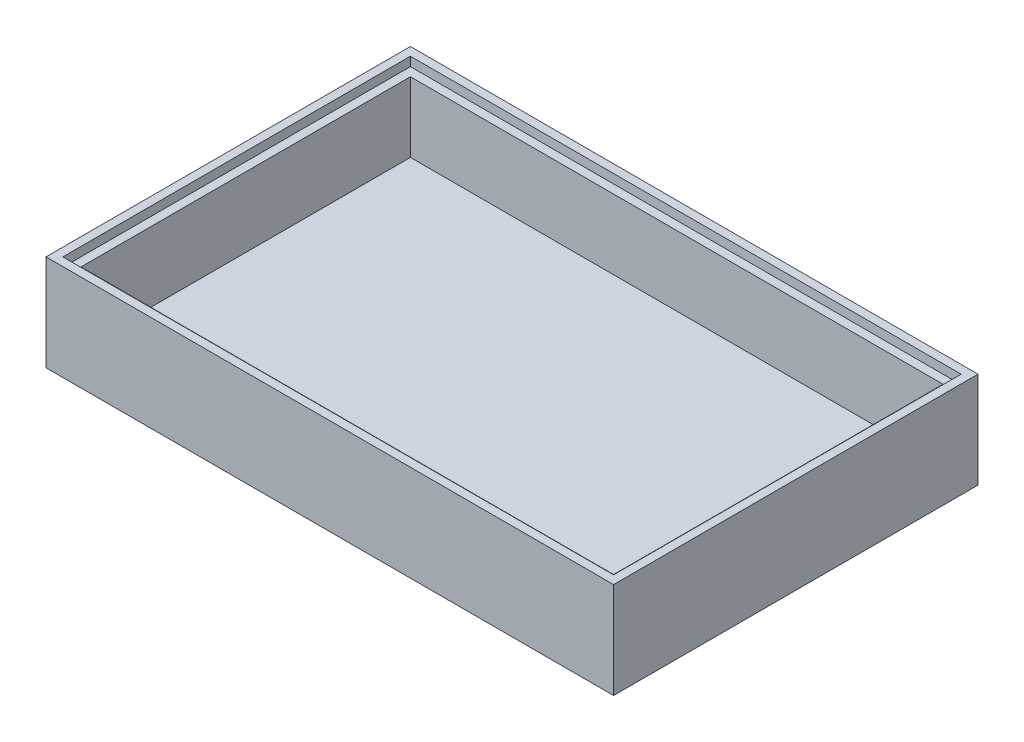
SolidWorks part; units mm, degrees
ref_plane "Front Plane" through (0, 0, 0) normal (0, 0, 1) x (1, 0, 0)
ref_plane "Top Plane" through (0, 0, 0) normal (0, 1, 0) x (1, 0, 0)
ref_plane "Right Plane" through (0, 0, 0) normal (1, 0, 0) x (0, 0, -1)
sketch "Sketch1" plane through (0, 0, 0) normal (0, 1, 0) x (1, 0, 0)
  line L1 (0, 0) -> (129.9664, 0)
  line L2 (0, 0) -> (0, -83.4381)
  line L3 (0, -83.4381) -> (129.9664, -83.4381)
  line L4 (129.9664, 0) -> (129.9664, -83.4381)
extrude "Boss-Extrude1" add sketch "Sketch1" along normal blind 20
shell "Shell1" thickness 4
other "Lip2" parameters "LipHeight"=2, "LipWidth"=2, "LipDraftAngle"=2, "D4"=0, "D5"=0, "D6"=2, "D7"=2, "D8"=2, "D9"=0
